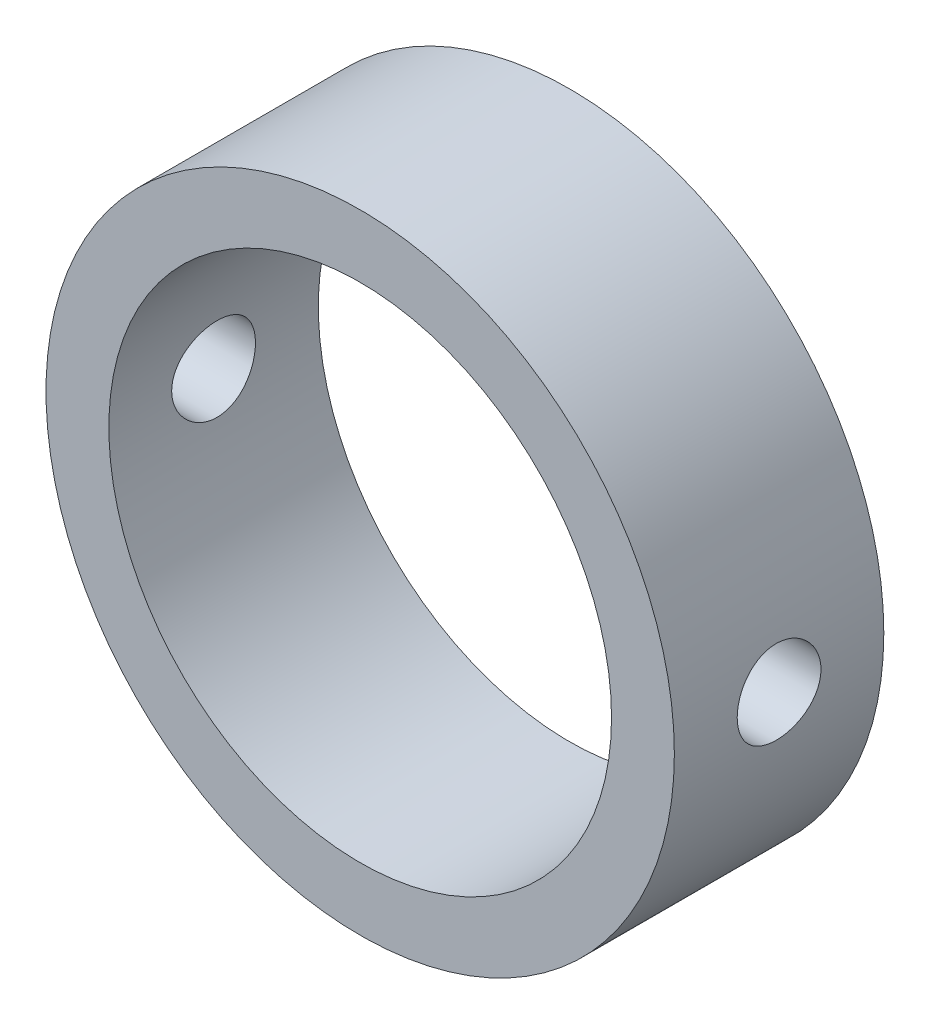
SolidWorks part; units mm, degrees
ref_plane "Plan de face" through (0, 0, 0) normal (0, 0, 1) x (1, 0, 0)
ref_plane "Plan de dessus" through (0, 0, 0) normal (0, 1, 0) x (1, 0, 0)
ref_plane "Plan de droite" through (0, 0, 0) normal (1, 0, 0) x (0, 0, -1)
sketch "Esquisse1" plane through (0, 0, 0) normal (0, 0, 1) x (1, 0, 0)
  circle A0 centre (0, 0) radius 30
  circle A1 centre (0, 0) radius 24
extrude "Extrusion1" add sketch "Esquisse1" along normal blind 20
sketch "Esquisse2" plane through (0, 0, 0) normal (1, 0, 0) x (0, 0, -1)
  line L0 (-20, 30) -> (-20, -30) construction
  circle A0 centre (-10, 0) radius 4
  dimension "D1" = 10
extrude "Enlèv. mat.-Extru.1" cut sketch "Esquisse2" against normal mid plane 80
